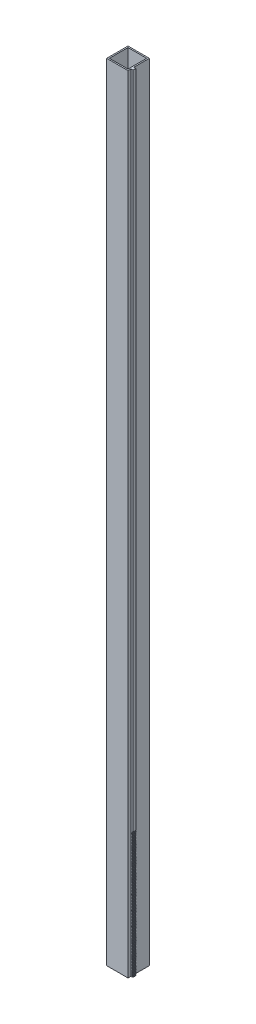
SolidWorks part; units mm, degrees
ref_plane "Front Plane" through (0, 0, 0) normal (0, 0, 1) x (1, 0, 0)
ref_plane "Top Plane" through (0, 0, 0) normal (0, 1, 0) x (1, 0, 0)
ref_plane "Right Plane" through (0, 0, 0) normal (1, 0, 0) x (0, 0, -1)
imported_body "Imported3"
sketch "Sketch1" plane through (0, 0, 43.8889) normal (0, 0, 1) x (1, 0, 0)
  line L0 (0, 0) -> (-50.8, 0)
  line L1 (-50.8, 0) -> (-50.8, 1873.25)
  line L2 (-50.8, 1873.25) -> (0, 1873.25)
  line L3 (0, 1873.25) -> (0, 0)
extrude "Boss-Extrude1" add sketch "Sketch1" along normal blind 6.9111
sketch "Sketch2" plane through (0, 1873.25, 0) normal (0, 1, 0) x (-1, 0, 0)
  line L0 (3.175, 3.175) -> (47.625, 3.175)
  line L1 (47.625, 3.175) -> (47.625, 47.625)
  line L2 (47.625, 47.625) -> (3.175, 47.625)
  line L3 (3.175, 47.625) -> (3.175, 3.175)
extrude "Cut-Extrude1" cut sketch "Sketch2" against normal through all
